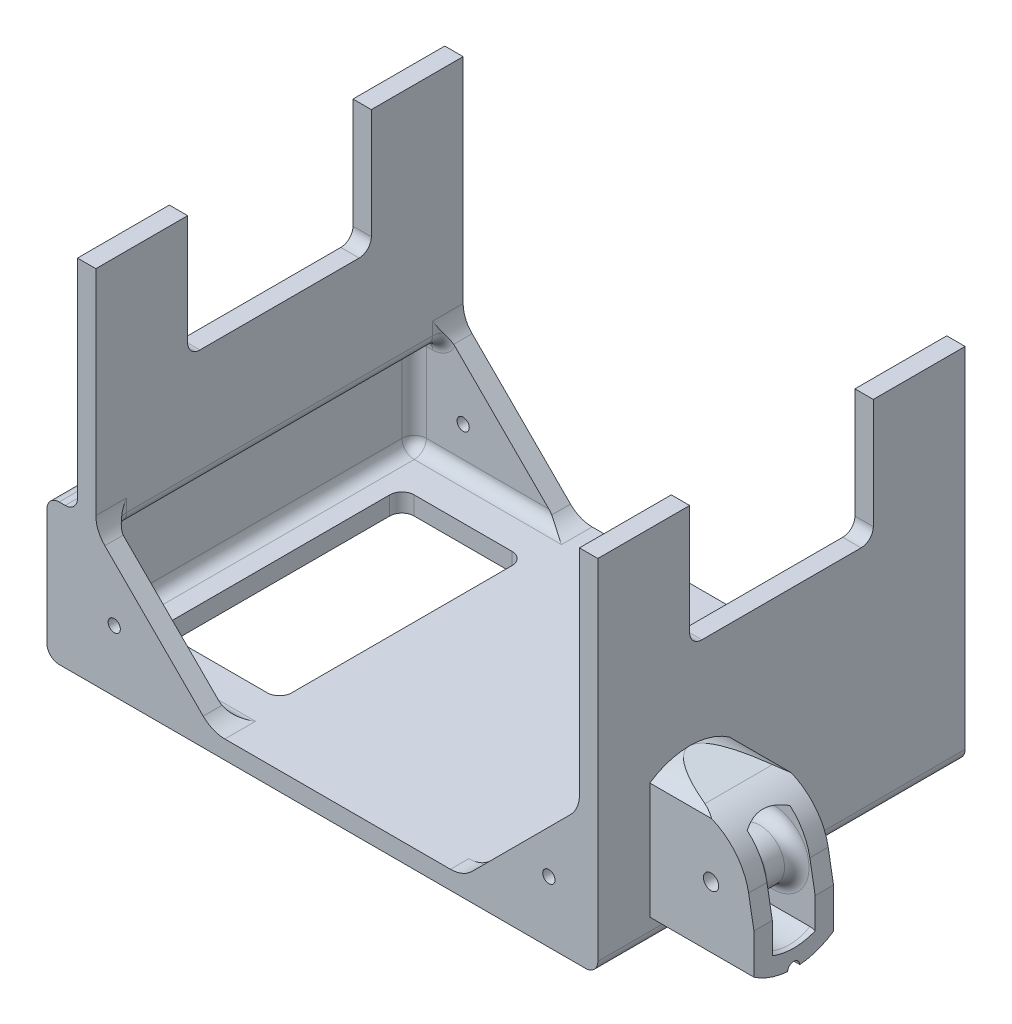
SolidWorks part; units mm, degrees
ref_plane "Plan de face" through (0, 0, 0) normal (0, 0, 1) x (1, 0, 0)
ref_plane "Plan de dessus" through (0, 0, 0) normal (0, 1, 0) x (1, 0, 0)
ref_plane "Plan de droite" through (0, 0, 0) normal (1, 0, 0) x (0, 0, -1)
sketch "Esquisse1" plane through (0, 0, 0) normal (0, 0, 1) x (1, 0, 0)
  line L0 (-3, 115) -> (-87, 115)
  line L1 (0, 0) -> (-90, 0)
  line L2 (0, 0) -> (0, 118)
  line L3 (0, 118) -> (-90, 118)
  line L4 (-90, 0) -> (-90, 20)
  line L5 (-87, 3) -> (-87, 20)
  line L6 (-3, 3) -> (-87, 3)
  line L7 (-3, 3) -> (-3, 115)
  line L8 (-90, 98) -> (-87, 98)
  line L9 (-90, 20) -> (-87, 20)
  line L10 (-87, 98) -> (-87, 115)
  line L11 (-90, 98) -> (-90, 118)
  line L12 (-87, 3) -> (-87, 115) construction
  line L14 (-90, 0) -> (-90, 118) construction
  dimension "D1" = 90
  dimension "D2" = 118
  dimension "D4" = 20
  dimension "D5" = 20
  dimension "D3" = 3
extrude "Boss.-Extru.2" add sketch "Esquisse1" along normal blind 60 contours L3 L11 L8 L10 L0 L7 L6 L5 L9 L4 L1 L2
ref_plane "Plan1" through (0, 0, 45) normal (0, 0, 1) x (1, 0, 0)
sketch "Esquisse2" plane through (0, 0, 0) normal (1, 0, 0) x (0, 0, -1)
  line L0 (-48.5, 112.246) -> (-48.5, 96.754)
  line L1 (-45, 84.9462) -> (-45, 52.4993) construction
  line L2 (-51.5, 113.9868) -> (-51.5, 95.0132)
  line L3 (-60, 0) -> (-60, 118) construction
  line L4 (-38.5, 113.9868) -> (-38.5, 95.0132)
  line L5 (-60, 118) -> (0, 118) construction
  line L6 (-76.0782, 45) -> (5.983, 45) construction
  line L7 (-41.5, 112.246) -> (-41.5, 96.754)
  line L10 (-81.25, 104.5) -> (-8.75, 104.5) construction
  arc A0 (-41.5, 96.754) -> (-48.5, 96.754) centre (-45, 104.5) cw
  arc A1 (-38.5, 113.9868) -> (-44.0009, 115.9565) centre (-45, 104.5) ccw
  arc A2 (-41.5, 112.246) -> (-48.5, 112.246) centre (-45, 104.5) ccw
  arc A3 (-45.9991, 115.9565) -> (-44.0009, 115.9565) centre (-45, 116) ccw
  arc A4 (-45.9991, 115.9565) -> (-51.5, 113.9868) centre (-45, 104.5) ccw
  arc A6 (-38.5, 113.9868) -> (-51.5, 113.9868) centre (-45, 104.5) ccw construction
  arc A7 (-38.5, 95.0132) -> (-51.5, 95.0132) centre (-45, 104.5) cw
  point P14 (-48.75, 57.5)
  point P16 (-61.25, 57.5)
extrude "Boss.-Extru.4" add sketch "Esquisse2" along normal blind 18.5
sketch "Esquisse5" plane through (0, 0, 45) normal (0, 0, 1) x (1, 0, 0)
  line L1 (0, 0) -> (0, 118) construction
  circle A0 centre (10, 104) radius 1.25
  point P6 (0, 59)
  dimension "D1" = 2.5
  dimension "D3" = 10
extrude "Enlèv. mat.-Extru.2" cut sketch "Esquisse5" against normal through all and the other way through all
sketch "Esquisse8" plane through (0, 0, 45) normal (0, 0, 1) x (1, 0, 0)
  circle A0 centre (10, 104) radius 4
  dimension "D1" = 8
extrude "Boss.-Extru.6" add sketch "Esquisse8" along normal up to surface and the other way up to surface
fillet "Congé3" radius 2 2 edges at (6, 104, 48.5) (14, 104, 41.5)
ref_plane "Plan2" through (0, 59, 0) normal (0, -1, 0) x (-1, 0, 0)
sketch "Esquisse9" plane through (0, 0, 60) normal (0, 0, 1) x (1, 0, 0)
  line L0 (-87, 98) -> (-82, 98)
  line L1 (-82, 98) -> (-82, 20)
  line L2 (-82, 20) -> (-87, 20)
  line L3 (-90, 20) -> (-90, 23)
  line L4 (-90, 23) -> (-85, 23)
  line L5 (-85, 23) -> (-85, 95)
  line L6 (-85, 95) -> (-90, 95)
  line L7 (-90, 95) -> (-90, 98)
  line L8 (-90, 98) -> (-87, 98)
  line L9 (-87, 20) -> (-90, 20)
  line L10 (-87, 98) -> (-87, 115) construction
  dimension "D1" = 3
  dimension "D2" = 3
  dimension "D3" = 3
  dimension "D4" = 5
extrude "Boss.-Extru.7" add sketch "Esquisse9" against normal up to surface (60 mm away)
sketch "Esquisse10" plane through (0, 0, 0) normal (0, -1, 0) x (1, 0, 0)
  line L0 (-82, 0) -> (-82, 60) construction
  line L1 (-82, 50) -> (-62, 50)
  line L2 (-82, 50) -> (-82, 10)
  line L3 (-82, 10) -> (-62, 10)
  line L4 (-62, 50) -> (-62, 10)
  line L5 (-90, 60) -> (-90, 0) construction
  point P8 (-90, 30)
extrude "Enlèv. mat.-Extru.3" cut sketch "Esquisse10" against normal up to next
sketch "Esquisse11" plane through (0, 118, 0) normal (0, 1, 0) x (1, 0, 0)
  line L0 (0, -60) -> (-90, -60) construction
  line L1 (-5, -60) -> (-55, -60)
  line L2 (-5, -60) -> (-5, -40)
  line L3 (-5, -40) -> (-55, -40)
  line L4 (-55, -60) -> (-55, -40)
  line L5 (0, -60) -> (0, 0) construction
  dimension "D1" = 20
  dimension "D2" = 50
  dimension "D3" = 5
extrude "Enlèv. mat.-Extru.4" cut sketch "Esquisse11" against normal up to next
sketch "Esquisse12" plane through (0, 0, 0) normal (1, 0, 0) x (0, 0, -1)
  line L2 (-30, 118) -> (-30, 0) construction
  line L3 (-60, 118) -> (0, 118) construction
  line L4 (-60, 0) -> (0, 0) construction
  line L6 (-45, 39) -> (-15, 39)
  line L7 (-45, 39) -> (-45, 79)
  line L8 (-45, 79) -> (-15, 79)
  line L9 (-15, 39) -> (-15, 79)
  line L10 (-45, 39) -> (-15, 79) construction
  line L11 (-45, 79) -> (-15, 39) construction
  point P0 (-30, 59)
  dimension "D1" = 40
  dimension "D2" = 30
extrude "Enlèv. mat.-Extru.5" cut sketch "Esquisse12" against normal through all
sketch "Esquisse13" plane through (0, 0, 0) normal (1, 0, 0) x (0, 0, -1)
  line L0 (-46.5, 104) -> (-43.5, 104) construction
  line L1 (-64.8515, 104) -> (-44.7368, 104) construction
  line L2 (-48.5, 104) -> (-51.5, 104) construction
  line L3 (-45, 121.2099) -> (-45, 85.4835) construction
  line L4 (-45, 38.5) -> (-45, -38.5) construction
  circle A0 centre (-45, 90.5) radius 1.5
  circle A1 centre (-45, 117.5) radius 1.5
  dimension "D1" = 3
  dimension "D2" = 13.5
extrude "Enlèv. mat.-Extru.6" cut sketch "Esquisse13" against normal up to next and the other way through all
fillet "Congé4" radius 2 29 edges at (-3, 3, 30) (-87, 3, 30) (-87, 20, 30) (-85, 23, 30) (-85, 95, 30) (-87, 98, 30) (-87, 115, 30) (-3, 115, 30) (0, 0, 30) (-90, 0, 30) (-82, 20, 30) (-90, 23, 30) (-90, 95, 30) (-90, 118, 30) (0, 118, 21.7929) (0, 118, 53.2071) (-82, 98, 30) (-62, 1.5, 50) (-82, 1.5, 50) (-62, 1.5, 10) (-82, 1.5, 10) (-83.5, 39, 15) (-83.5, 39, 45) (-83.5, 79, 45) (-83.5, 79, 15) (-1.5, 79, 15) (-1.5, 79, 45) (-1.5, 39, 45) (-1.5, 39, 15)
sketch "Esquisse14" plane through (0, 0, 0) normal (0, 0, -1) x (-1, 0, 0)
  line L0 (85, 93) -> (-3.2573, 93) construction
  line L2 (85, 93) -> (60, 118)
  line L3 (-18.5, 93) -> (0, 93) construction
  line L4 (0, 93) -> (25, 118)
  line L5 (0, 59) -> (87, 59) construction
  line L6 (-49.5094, 59) -> (49.5094, 59) construction
  line L7 (85, 25) -> (60, 0)
  line L8 (0, 116) -> (0, 2)
  line L9 (2, 0) -> (88, 0)
  line L10 (90, 2) -> (90, 21)
  line L11 (88, 23) -> (87, 23)
  line L12 (85, 25) -> (85, 93)
  line L13 (87, 95) -> (88, 95)
  line L14 (90, 97) -> (90, 116)
  line L15 (88, 118) -> (2, 118)
  line L16 (0, 116) -> (0, 93)
  line L17 (2, 0) -> (25, 0)
  line L18 (90, 2) -> (90, 21)
  line L19 (88, 23) -> (87, 23)
  line L21 (87, 95) -> (88, 95)
  line L22 (90, 97) -> (90, 116)
  line L23 (88, 118) -> (60, 118)
  line L24 (0, 25) -> (25, 0)
  line L25 (25, 118) -> (2, 118)
  line L26 (0, 25) -> (0, 2)
  line L27 (60, 0) -> (88, 0)
  circle A0 centre (79, 108) radius 1
  circle A1 centre (8, 108) radius 1
  circle A2 centre (79, 10) radius 1
  circle A3 centre (8, 10) radius 1
  arc A8 (0, 2) -> (2, 0) centre (2, 2) ccw
  arc A9 (88, 0) -> (90, 2) centre (88, 2) ccw
  arc A10 (90, 21) -> (88, 23) centre (88, 21) ccw
  arc A11 (85, 25) -> (87, 23) centre (87, 25) ccw
  arc A12 (87, 95) -> (85, 93) centre (87, 93) ccw
  arc A13 (88, 95) -> (90, 97) centre (88, 97) ccw
  arc A14 (90, 116) -> (88, 118) centre (88, 116) ccw
  arc A15 (2, 118) -> (0, 116) centre (2, 116) ccw
  arc A16 (0, 2) -> (2, 0) centre (2, 2) ccw
  arc A17 (88, 0) -> (90, 2) centre (88, 2) ccw
  arc A18 (90, 21) -> (88, 23) centre (88, 21) ccw
  arc A19 (85, 25) -> (87, 23) centre (87, 25) ccw
  arc A20 (87, 95) -> (85, 93) centre (87, 93) ccw
  arc A21 (88, 95) -> (90, 97) centre (88, 97) ccw
  arc A22 (90, 116) -> (88, 118) centre (88, 116) ccw
  arc A23 (2, 118) -> (0, 116) centre (2, 116) ccw
  dimension "D4" = 2
  dimension "D6" = 10
  dimension "D7" = 2
  dimension "D8" = 8
  dimension "D9" = 10
  dimension "D2" = 45
  dimension "D3" = 45
  dimension "D5" = 11
  dimension "D1" = 0
extrude "Boss.-Extru.8" add sketch "Esquisse14" against normal blind 3
pattern_linear "Répétition linéaire1" count 2 spacing 57 along (0, 0, 1) of "Boss.-Extru.8"
sketch "Esquisse15" plane through (0, 0, 57) normal (0, 0, -1) x (-1, 0, 0)
  line L4 (5, 118) -> (5, 115)
  line L5 (3, 113) -> (3, 96)
  line L6 (3, 96) -> (25, 118)
  line L7 (25, 118) -> (5, 118)
  line L8 (5, 118) -> (5, 115)
  line L9 (3, 113) -> (3, 96)
  line L10 (3, 96) -> (25, 118)
  line L11 (25, 118) -> (5, 118)
  arc A1 (5, 115) -> (3, 113) centre (5, 113) ccw
  arc A2 (5, 115) -> (3, 113) centre (5, 113) ccw
  dimension "D1" = 0
extrude "Enlèv. mat.-Extru.7" cut sketch "Esquisse15" against normal through all
sketch "Esquisse16" plane through (0, 0, 45) normal (0, 0, 1) x (1, 0, 0)
  line L0 (18.5, 115.95) -> (16.133, 102.526)
  line L1 (8.0214, 94.4144) -> (0, 93)
  line L2 (18.5, 113.9868) -> (18.5, 95.0132) construction
  line L3 (0, 93) -> (18.5, 93) construction
  line L4 (18.5, 115.95) -> (18.5, 93)
  line L5 (18.5, 93) -> (0, 93)
  arc A0 (16.133, 102.526) -> (8.0214, 94.4144) centre (6.2849, 104.2625) cw
  dimension "D1" = 10
  dimension "D2" = 10
  dimension "D3" = 10
extrude "Enlèv. mat.-Extru.8" cut sketch "Esquisse16" against normal through all both and the other way through all
sketch "Esquisse17" plane through (0, 0, 0) normal (1, 0, 0) x (0, 0, -1)
  line L4 (-41.5, 96.754) -> (-41.5, 112.246)
  line L5 (-41.5, 96.754) -> (-41.5, 112.246)
  line L6 (-48.5, 112.246) -> (-48.5, 96.754)
  line L7 (-48.5, 112.246) -> (-48.5, 96.754)
  arc A4 (-41.5, 112.246) -> (-48.5, 112.246) centre (-45, 104.5) ccw
  arc A5 (-41.5, 112.246) -> (-48.5, 112.246) centre (-45, 104.5) ccw
  arc A6 (-48.5, 96.754) -> (-41.5, 96.754) centre (-45, 104.5) ccw
  arc A7 (-48.5, 96.754) -> (-41.5, 96.754) centre (-45, 104.5) ccw
  dimension "D1" = 0
extrude "Enlèv. mat.-Extru.9" cut sketch "Esquisse17" against normal up to next
mirror "Symétrie3" about plane through (0, 59, 0) normal (0, -1, 0) of "Enlèv. mat.-Extru.8", "Enlèv. mat.-Extru.9", "Congé3", "Enlèv. mat.-Extru.2", "Boss.-Extru.4", "Boss.-Extru.6"
fillet "Congé5" radius 5 14 edges at (-82, 96, 58.5) (-63, 115, 58.5) (-82, 96, 1.5) (-63, 115, 1.5) (-22, 115, 1.5) (-3, 96, 1.5) (-63, 3, 58.5) (-82, 22, 58.5) (-82, 22, 1.5) (-63, 3, 1.5) (-22, 3, 1.5) (-22, 3, 58.5) (-3, 22, 58.5) (-3, 22, 1.5)
fillet "Congé6" radius 2 38 edges at (-3, 14.5355, 3) (-3.5858, 3.5858, 3) (-3, 103.4645, 3) (-3.5858, 114.4142, 3) (-82, 94.9645, 3) (-82.5858, 97.4142, 3) (-84.5, 98, 3) (-86.4142, 98.5858, 3) (-87, 106.5, 3) (-86.4142, 114.4142, 3) (-82, 94.9645, 57) (-82.5858, 97.4142, 57) (-84.5, 98, 57) (-86.4142, 98.5858, 57) (-87, 106.5, 57) (-86.4142, 114.4142, 57) (-14.5355, 3, 3) (-14.5355, 115, 3) (-72.9645, 115, 3) (-72.9645, 115, 57) (-82, 23.0355, 57) (-82.5858, 20.5858, 57) (-84.5, 20, 57) (-86.4142, 19.4142, 57) (-72.9645, 3, 57) (-86.4142, 3.5858, 57) (-87, 11.5, 57) (-82, 23.0355, 3) (-82.5858, 20.5858, 3) (-84.5, 20, 3) (-86.4142, 19.4142, 3) (-87, 11.5, 3) (-86.4142, 3.5858, 3) (-72.9645, 3, 3) (17.9798, 113, 45) (17.9798, 5, 45) (-3, 22, 45) (-3, 96, 45)
sketch "Esquisse18" plane through (0, 115, 0) normal (0, -1, 0) x (1, 0, 0)
  line L0 (-5, 3) -> (-20, 3) construction
  line L1 (-5, 40) -> (-55, 40) construction
  line L2 (-8, 40) -> (-3, 40)
  line L3 (-8, 40) -> (-8, 3)
  line L4 (-8, 3) -> (-3, 3)
  line L5 (-3, 40) -> (-3, 3)
  line L7 (-3, 45) -> (-3, 5) construction
  dimension "D1" = 5
  dimension "D2" = 5
extrude "Boss.-Extru.9" add sketch "Esquisse18" along normal blind 2
fillet "Congé7" radius 2 3 edges at (-6.5, 113, 3) (-3.5858, 113, 3.5858) (-3, 113, 22.5)
sketch "Esquisse19" plane through (0, 118, 0) normal (0, 1, 0) x (1, 0, 0)
  line L0 (-68.5, -38.5217) -> (-68.5, -3.2296) construction
  line L1 (-12.5, -38.5217) -> (-12.5, -3) construction
  line L2 (-12.5, -33.1377) -> (-12.5, -8.106) construction
  line L3 (-13.5, -33.1377) -> (-13.5, -8.106)
  line L4 (-11.5, -33.1377) -> (-11.5, -8.106)
  line L5 (-68.5, -33.1377) -> (-68.5, -8.106) construction
  line L9 (-69.5, -33.1377) -> (-69.5, -8.106)
  line L10 (-8, -3) -> (-20, -3) construction
  line L12 (-67.5, -33.1377) -> (-67.5, -8.106)
  arc A0 (-13.5, -33.1377) -> (-11.5, -33.1377) centre (-12.5, -33.1377) ccw
  arc A1 (-11.5, -8.106) -> (-13.5, -8.106) centre (-12.5, -8.106) ccw
  arc A2 (-69.5, -33.1377) -> (-67.5, -33.1377) centre (-68.5, -33.1377) ccw
  arc A3 (-67.5, -8.106) -> (-69.5, -8.106) centre (-68.5, -8.106) ccw
  point P8 (-12.5, -20.6219)
  point P17 (-68.5, -20.6219)
  dimension "D1" = 1
  dimension "D2" = 2
extrude "Enlèv. mat.-Extru.10" cut sketch "Esquisse19" against normal up to next
fillet "Congé8" radius 1 1 edges at (18.3325, 115, 45)
fillet "Congé9" radius 1 6 edges at (-3.5, 118, 43.5858) (-0.1314, 116.7129, 46.2769) (-0.2989, 117.0518, 43.5685) (-5, 116, 45) (0, 90.5, 46.5) (-3, 90.5, 46.5)
sketch "Esquisse20" plane through (0, 0, 45) normal (0, 0, 1) x (1, 0, 0)
  line L1 (17, 118.6789) -> (31.4716, 118.6789)
  line L2 (17, 118.6789) -> (17, -11.9808)
  line L3 (17, -11.9808) -> (31.4716, -11.9808)
  line L4 (31.4716, 118.6789) -> (31.4716, -11.9808)
  dimension "D1" = 7
extrude "Enlèv. mat.-Extru.11" cut sketch "Esquisse20" against normal through all both and the other way through all
sketch "Esquisse21" plane through (0, 59, 0) normal (0, -1, 0) x (-1, 0, 0)
  line L1 (103.8415, 8.1443) -> (-35.4908, 8.1443)
  line L2 (103.8415, 8.1443) -> (103.8415, -69.4222)
  line L3 (103.8415, -69.4222) -> (-35.4908, -69.4222)
  line L4 (-35.4908, 8.1443) -> (-35.4908, -69.4222)
extrude "Enlèv. mat.-Extru.12" cut sketch "Esquisse21" against normal through all
equation "\"D4@Esquisse2\"=\"D2@Esquisse2\"/2"
equation "\"D2@Esquisse10\"=\"D1@Esquisse10\"/2"
